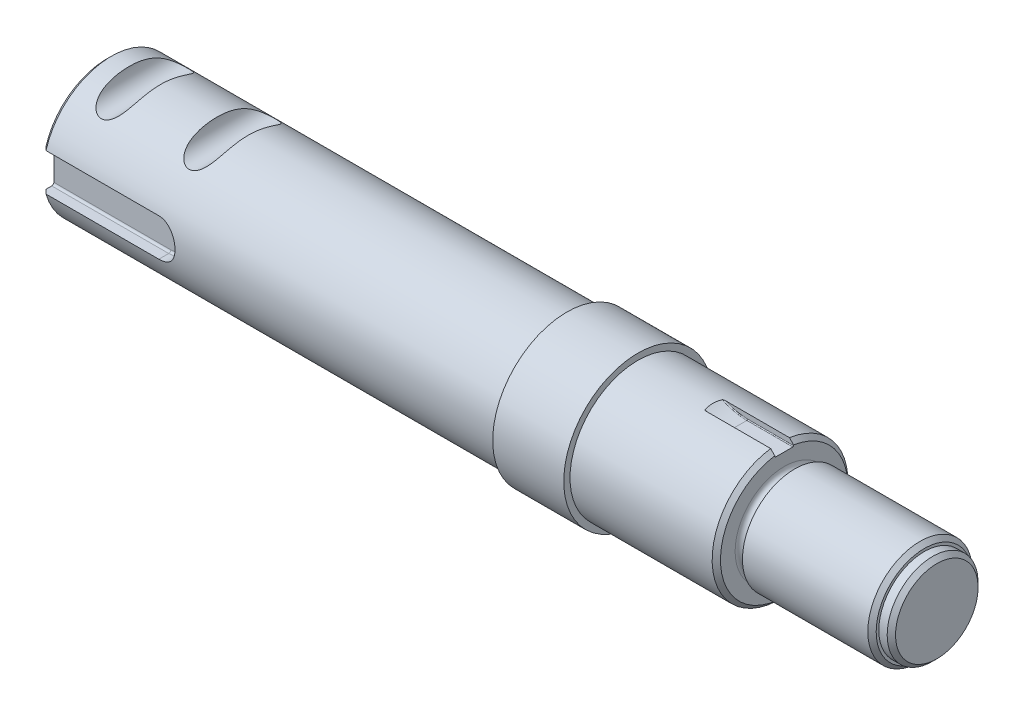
SolidWorks part; units mm, degrees
ref_plane "Plan de face" through (0, 0, 0) normal (0, 0, 1) x (1, 0, 0)
ref_plane "Plan de dessus" through (0, 0, 0) normal (0, 1, 0) x (1, 0, 0)
ref_plane "Plan de droite" through (0, 0, 0) normal (1, 0, 0) x (0, 0, -1)
sketch "Esquisse4" plane through (0, 0, 0) normal (0, 0, 1) x (1, 0, 0)
  line L0 (0, 32.5) -> (0, 0)
  line L2 (0, 0) -> (397, 0)
  line L3 (322, 32.5) -> (0, 32.5)
  line L4 (0, 0) -> (408.185, 0) construction
  line L5 (322, 32.5) -> (324, 30.5)
  line L9 (324, 30.5) -> (324, 23.5)
  line L10 (329, 23.5) -> (329, 25)
  line L11 (329, 25) -> (391, 25)
  line L12 (391, 25) -> (391, 21.75)
  line L13 (391, 21.75) -> (397, 21.75)
  line L14 (397, 21.75) -> (397, 0)
  arc A0 (324, 23.5) -> (329, 23.5) centre (326.5, 23.5) ccw
  point P12 (277, 0)
  dimension "D5" = 2.5
  dimension "D7" = 32.5
  dimension "D4" = 25
  dimension "D6" = 5
  dimension "D8" = 2
  dimension "D10" = 397
  dimension "D11" = 23.5
  dimension "D12" = 6
  dimension "D13" = 21.75
  dimension "D15" = 73
revolve "Révolution1" add sketch "Esquisse4" angle 360 about L4
chamfer "Chanfrein1" distance 2 angle 45 2 edges at (397, 0, 21.75) (391, 0, 25)
chamfer "Chanfrein2" distance 2 angle 45 1 edges at (0, 0, 32.5)
sketch "Esquisse5" plane through (0, 0, 0) normal (0, 0, 1) x (1, 0, 0)
  line L0 (322, 32.5) -> (2, 32.5) construction
  line L1 (0, 30.5) -> (0, -30.5) construction
  line L2 (2, -32.5) -> (322, -32.5) construction
  circle A0 centre (18, 32.5) radius 7.5
  circle A1 centre (60, 32.5) radius 7.5
  circle A2 centre (18, -32.5) radius 7.5
  circle A3 centre (60, -32.5) radius 7.5
  dimension "D1" = 15
  dimension "D2" = 15
  dimension "D5" = 15
  dimension "D6" = 15
  dimension "D7" = 42
  dimension "D3" = 18
  dimension "D4" = 60
  dimension "D8" = 60
extrude "Extrusion3" cut sketch "Esquisse5" against normal mid plane 152
ref_plane "Plan1" through (0, 0, 32.5) normal (0, 0, 1) x (1, 0, 0)
sketch "Esquisse6" plane through (0, 0, 32.5) normal (0, 0, 1) x (1, 0, 0)
  line L0 (0, 30.5) -> (0, -30.5) construction
  line L1 (0, 9) -> (56, 9)
  line L2 (0, 9) -> (0, -9)
  line L3 (0, -9) -> (56, -9)
  line L5 (0, 0) -> (97.6711, 0) construction
  arc A0 (56, 9) -> (56, -9) centre (56, 0) cw
  dimension "D2" = 9
  dimension "D1" = 18
  dimension "D3" = 56
extrude "Extrusion4" cut sketch "Esquisse6" against normal blind 7
sketch "Esquisse7" plane through (0, 0, 0) normal (0, 0, 1) x (1, 0, 0)
  line L0 (324, 29.5) -> (302, 29.5)
  line L1 (324, -30.5) -> (324, 30.5) construction
  line L2 (397, -19.75) -> (397, 19.75) construction
  line L4 (276.5788, 48.516) -> (324, 48.516)
  line L5 (324, 48.516) -> (324, 29.5)
  arc A0 (302, 29.5) -> (276.5788, 48.516) centre (302, 56) cw
  dimension "D2" = 26.5
  dimension "D1" = 95
extrude "Extrusion5" cut sketch "Esquisse7" against normal mid plane 9
fillet "Congé2" radius 1 3 edges at (28, -9, 25.5) (65, 0, 25.5) (28, 9, 25.5)
fillet "Congé3" radius 0.4 4 edges at (296.0332, 30.1805, 4.5) (296.0332, 30.1805, -4.5) (313, 29.5, 4.5) (313, 29.5, -4.5)
sketch "Esquisse8" plane through (0, 0, 0) normal (0, 0, 1) x (1, 0, 0)
  line L0 (289.7526, 32.5) -> (67.5, 32.5) construction
  line L1 (220, 32.5) -> (254, 32.5)
  line L2 (220, 32.5) -> (220, 35.5)
  line L3 (220, 35.5) -> (254, 35.5)
  line L4 (254, 32.5) -> (254, 35.5)
  dimension "D1" = 34
  dimension "D2" = 3
  dimension "D3" = 68
revolve "Révolution2" add sketch "Esquisse8" angle 360 about axis through (0, 0, 0) along (-1, 0, 0)
